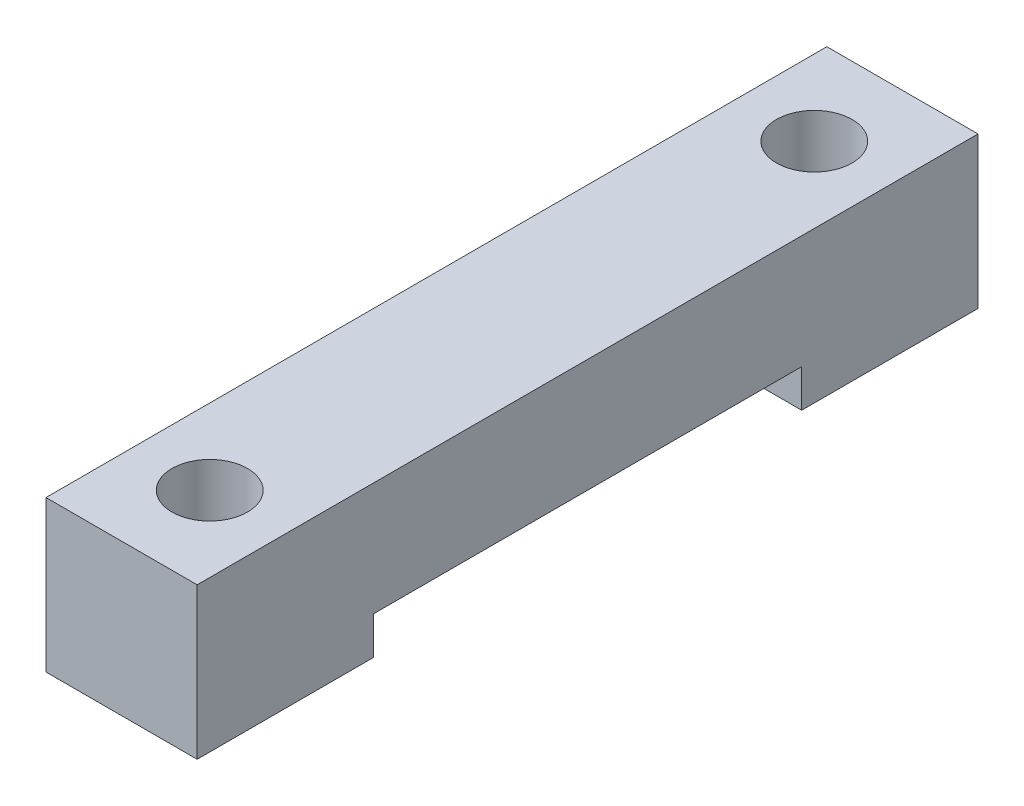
SolidWorks part; units mm, degrees
ref_plane "Front Plane" through (0, 0, 0) normal (0, 0, 1) x (1, 0, 0)
ref_plane "Top Plane" through (0, 0, 0) normal (0, 1, 0) x (1, 0, 0)
ref_plane "Right Plane" through (0, 0, 0) normal (1, 0, 0) x (0, 0, -1)
sketch "Sketch1" plane through (0, 0, 0) normal (0, 1, 0) x (1, 0, 0)
  line L0 (6, 62) -> (6, 0) construction
  line L1 (0, 0) -> (12, 0)
  line L2 (0, 0) -> (0, 62)
  line L3 (0, 62) -> (12, 62)
  line L4 (12, 0) -> (12, 62)
  circle A0 centre (6, 55) radius 3
  circle A1 centre (6, 7) radius 3
  dimension "D2" = 6
  dimension "D3" = 6
  dimension "D4" = 7
  dimension "D5" = 7
  dimension "D1" = 12
  dimension "D6" = 62
extrude "Extrude1" add sketch "Sketch1" along normal blind 12
sketch "Sketch2" plane through (12, 0, 0) normal (1, 0, 0) x (0, 0, -1)
  line L0 (0, 0) -> (62, 0) construction
  line L1 (14, 0) -> (48, 0)
  line L2 (14, 0) -> (14, 3)
  line L3 (14, 3) -> (48, 3)
  line L4 (48, 0) -> (48, 3)
  line L5 (62, 12) -> (62, 0) construction
  line L6 (0, 12) -> (0, 0) construction
  dimension "D1" = 14
  dimension "D2" = 14
  dimension "D3" = 3
extrude "Extrude2" cut sketch "Sketch2" against normal through all
